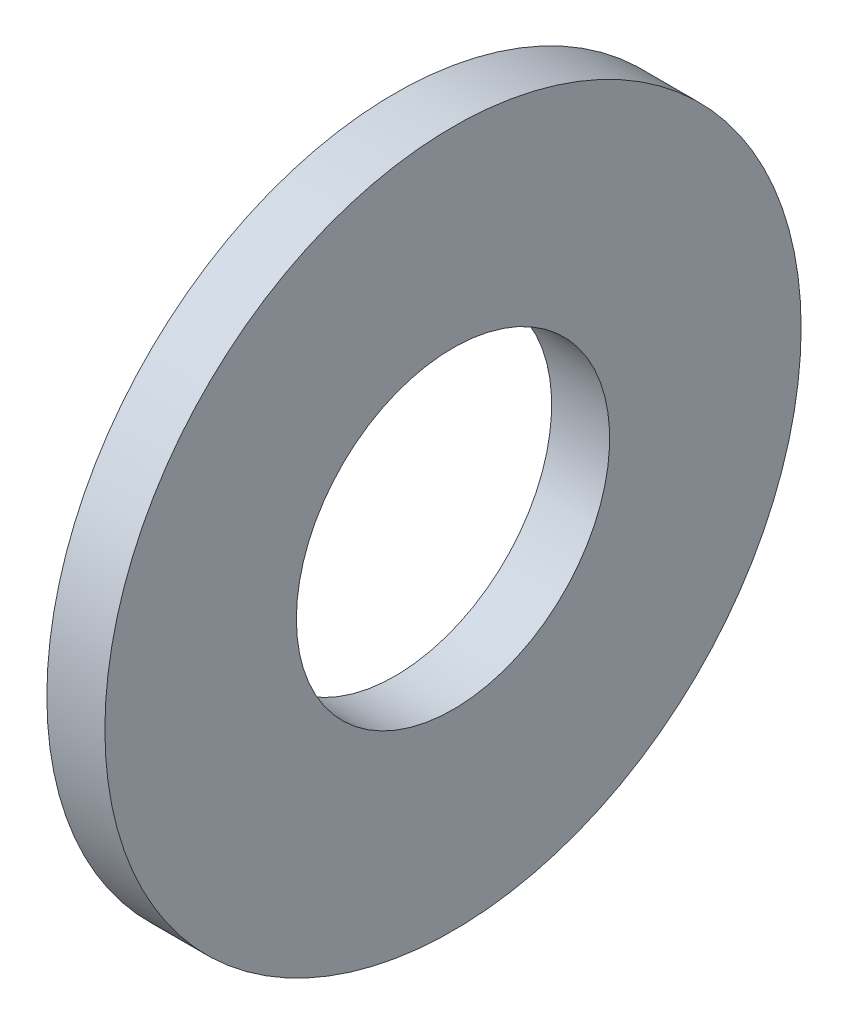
SolidWorks part; units mm, degrees
ref_plane "Plane1" through (0, 0, 0) normal (0, 0, 1) x (1, 0, 0)
ref_plane "Plane2" through (0, 0, 0) normal (0, 1, 0) x (1, 0, 0)
ref_plane "Plane3" through (0, 0, 0) normal (1, 0, 0) x (0, 0, -1)
sketch "Sketch1" plane through (0, 0, 0) normal (0, 0, 1) x (1, 0, 0)
  line L0 (-34.925, 0) -> (9.525, 0) construction
  line L1 (0, 1.35) -> (0, 3)
  line L2 (0, 3) -> (-0.5, 3)
  line L3 (-0.5, 3) -> (-0.5, 1.35)
  line L4 (-0.5, 1.35) -> (0, 1.35)
  dimension "Thickness" = 0.5
  dimension "Inside_dia" = 2.7
  dimension "Outside_dia" = 6
revolve "Base-Revolve" add sketch "Sketch1" angle 360 about L0
